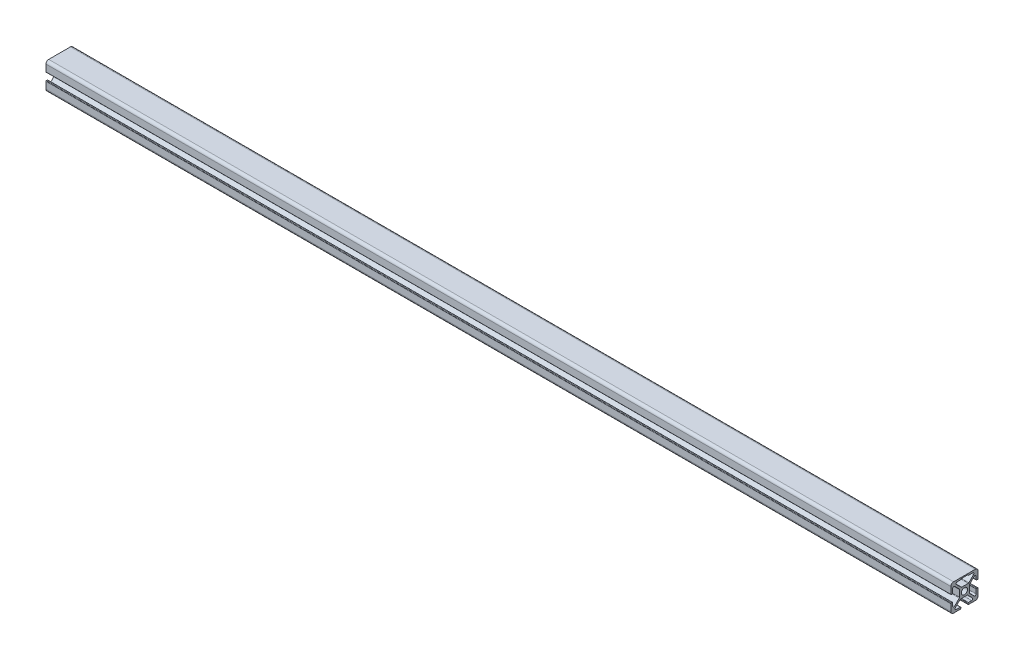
SolidWorks part; units mm, degrees
ref_plane "Ebene vorne" through (0, 0, 0) normal (0, 0, 1) x (1, 0, 0)
ref_plane "Ebene oben" through (0, 0, 0) normal (0, 1, 0) x (1, 0, 0)
ref_plane "Ebene rechts" through (0, 0, 0) normal (1, 0, 0) x (0, 0, -1)
sketch "Skizze1" plane through (0, 0, 0) normal (0, 1, 0) x (1, 0, 0)
  line L0 (0, 0) -> (1000, 0)
  dimension "D1" = 1000
other "Strukturbauteil1"
ref_plane "Ebene1" through (0, 0, 0) normal (1, 0, 0) x (0, 0, -1)
sketch "Model" plane through (0, 0, 0) normal (1, 0, 0) x (0, 0, -1)
  line L0 (3.7, 13.8) -> (-3.7, 13.8)
  line L1 (-4.5, 13) -> (-7.9023, 13)
  line L2 (-8.8199, 10.7846) -> (-3.7282, 5.6929)
  line L3 (-3.0211, 5.4) -> (4.2211, 5.4)
  line L4 (4.9282, 5.6929) -> (10.0199, 10.7846)
  line L5 (9.1023, 13) -> (4.5, 13)
  line L6 (-14.5, 4) -> (-13.5, 4)
  line L7 (-13, 4.5) -> (-13, 9.1023)
  line L8 (-10.7846, 10.0199) -> (-5.6929, 4.9282)
  line L9 (-5.4, 4.2211) -> (-5.4, -3.0211)
  line L10 (-5.6929, -3.7282) -> (-10.7846, -8.8199)
  line L11 (-13, -7.9023) -> (-13, -4.5)
  line L12 (-13.5, -4) -> (-14.5, -4)
  line L13 (-15, -4.5) -> (-15, -12)
  line L14 (-12, -15) -> (-4.5, -15)
  line L15 (-4, -14.5) -> (-4, -13.5)
  line L16 (-4.5, -13) -> (-9.1023, -13)
  line L17 (-10.0199, -10.7846) -> (-4.9282, -5.6929)
  line L18 (-4.2211, -5.4) -> (3.0211, -5.4)
  line L19 (3.7282, -5.6929) -> (8.8199, -10.7846)
  line L20 (7.9023, -13) -> (4.5, -13)
  line L21 (4, -13.5) -> (4, -14.5)
  line L22 (4.5, -15) -> (12, -15)
  line L23 (15, -12) -> (15, -4.5)
  line L24 (14.5, -4) -> (13.5, -4)
  line L25 (13, -4.5) -> (13, -9.1023)
  line L26 (10.7846, -10.0199) -> (5.6929, -4.9282)
  line L27 (5.4, -4.2211) -> (5.4, 3.0211)
  line L28 (5.6929, 3.7282) -> (10.7846, 8.8199)
  line L29 (13, 7.9023) -> (13, 4.5)
  line L30 (13.5, 4) -> (14.5, 4)
  line L31 (15, 4.5) -> (15, 12)
  line L32 (12, 15) -> (-12, 15)
  line L33 (-15, 12) -> (-15, 4.5)
  line L35 (-15, 15) -> (15, 15) construction
  line L36 (-15, 15) -> (-15, -15) construction
  line L37 (-15, -15) -> (15, -15) construction
  line L38 (15, 15) -> (15, -15) construction
  line L39 (-15, 15) -> (15, -15) construction
  line L40 (-15, -15) -> (15, 15) construction
  circle A0 centre (0, 0) radius 3.4
  arc A1 (4, 13.5) -> (3.7, 13.8) centre (3.7, 13.5) ccw
  arc A2 (-3.7, 13.8) -> (-4, 13.5) centre (-3.7, 13.5) ccw
  arc A3 (-4.5, 13) -> (-4, 13.5) centre (-4.5, 13.5) ccw
  arc A4 (-7.9023, 13) -> (-8.8199, 10.7846) centre (-7.9023, 11.7023) ccw
  arc A5 (-3.7282, 5.6929) -> (-3.0211, 5.4) centre (-3.0211, 6.4) ccw
  arc A6 (4.2211, 5.4) -> (4.9282, 5.6929) centre (4.2211, 6.4) ccw
  arc A7 (10.0199, 10.7846) -> (9.1023, 13) centre (9.1023, 11.7023) ccw
  arc A8 (4, 13.5) -> (4.5, 13) centre (4.5, 13.5) ccw
  arc A9 (-13.5, 4) -> (-13, 4.5) centre (-13.5, 4.5) ccw
  arc A10 (-10.7846, 10.0199) -> (-13, 9.1023) centre (-11.7023, 9.1023) ccw
  arc A11 (-5.4, 4.2211) -> (-5.6929, 4.9282) centre (-6.4, 4.2211) ccw
  arc A12 (-5.6929, -3.7282) -> (-5.4, -3.0211) centre (-6.4, -3.0211) ccw
  arc A13 (-13, -7.9023) -> (-10.7846, -8.8199) centre (-11.7023, -7.9023) ccw
  arc A14 (-13, -4.5) -> (-13.5, -4) centre (-13.5, -4.5) ccw
  arc A15 (-14.5, -4) -> (-15, -4.5) centre (-14.5, -4.5) ccw
  arc A16 (-15, -12) -> (-12, -15) centre (-12, -12) ccw
  arc A17 (-4.5, -15) -> (-4, -14.5) centre (-4.5, -14.5) ccw
  arc A18 (-4, -13.5) -> (-4.5, -13) centre (-4.5, -13.5) ccw
  arc A19 (-10.0199, -10.7846) -> (-9.1023, -13) centre (-9.1023, -11.7023) ccw
  arc A20 (-4.2211, -5.4) -> (-4.9282, -5.6929) centre (-4.2211, -6.4) ccw
  arc A21 (3.7282, -5.6929) -> (3.0211, -5.4) centre (3.0211, -6.4) ccw
  arc A22 (7.9023, -13) -> (8.8199, -10.7846) centre (7.9023, -11.7023) ccw
  arc A23 (4.5, -13) -> (4, -13.5) centre (4.5, -13.5) ccw
  arc A24 (4, -14.5) -> (4.5, -15) centre (4.5, -14.5) ccw
  arc A25 (12, -15) -> (15, -12) centre (12, -12) ccw
  arc A26 (15, -4.5) -> (14.5, -4) centre (14.5, -4.5) ccw
  arc A27 (13.5, -4) -> (13, -4.5) centre (13.5, -4.5) ccw
  arc A28 (10.7846, -10.0199) -> (13, -9.1023) centre (11.7023, -9.1023) ccw
  arc A29 (5.4, -4.2211) -> (5.6929, -4.9282) centre (6.4, -4.2211) ccw
  arc A30 (5.6929, 3.7282) -> (5.4, 3.0211) centre (6.4, 3.0211) ccw
  arc A31 (13, 7.9023) -> (10.7846, 8.8199) centre (11.7023, 7.9023) ccw
  arc A32 (13, 4.5) -> (13.5, 4) centre (13.5, 4.5) ccw
  arc A33 (14.5, 4) -> (15, 4.5) centre (14.5, 4.5) ccw
  arc A34 (15, 12) -> (12, 15) centre (12, 12) ccw
  arc A35 (-12, 15) -> (-15, 12) centre (-12, 12) ccw
  arc A36 (-15, 4.5) -> (-14.5, 4) centre (-14.5, 4.5) ccw
  point P108 (0, 0)
  point P113 (-15, 0)
  point P114 (0, 15)
  point P115 (15, 0)
  point P116 (0, -15)
  point P117 (0, 0)
